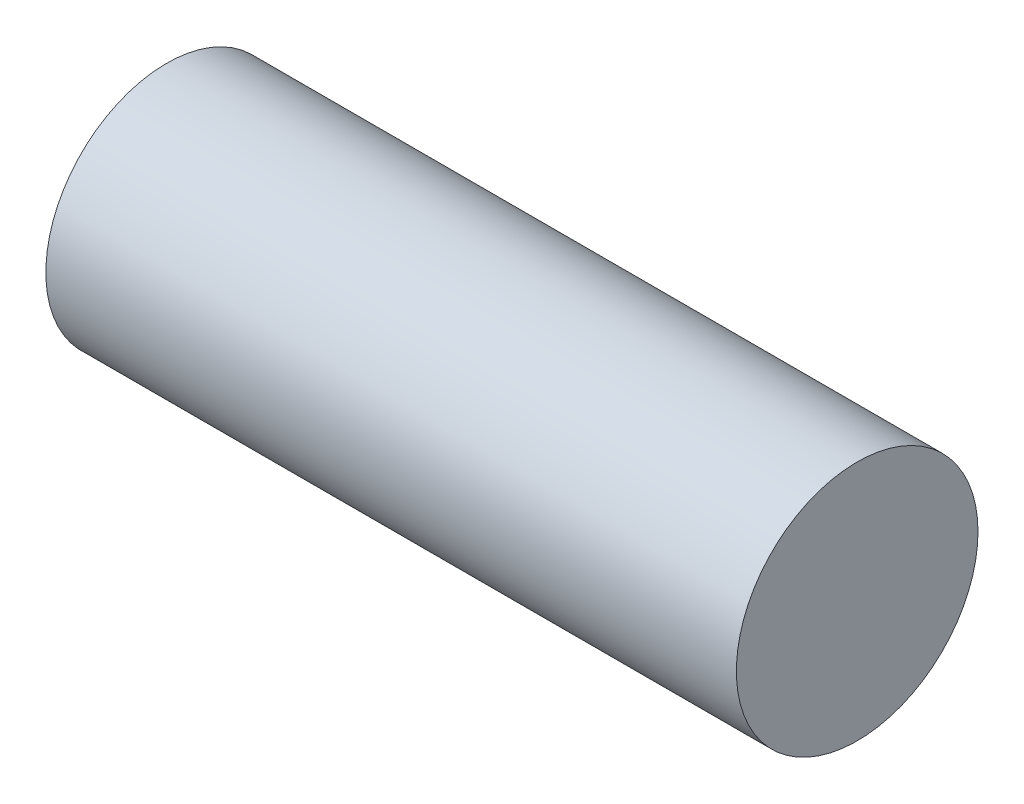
SolidWorks part; units mm, degrees
ref_plane "Front Plane" through (0, 0, 0) normal (0, 0, 1) x (1, 0, 0)
ref_plane "Top Plane" through (0, 0, 0) normal (0, 1, 0) x (1, 0, 0)
ref_plane "Right Plane" through (0, 0, 0) normal (1, 0, 0) x (0, 0, -1)
sketch "Sketch1" plane through (0, 0, 0) normal (1, 0, 0) x (0, 0, -1)
  circle A0 centre (0, 0) radius 5
  dimension "D1" = 10
extrude "Boss-Extrude1" add sketch "Sketch1" along normal blind 28.58
